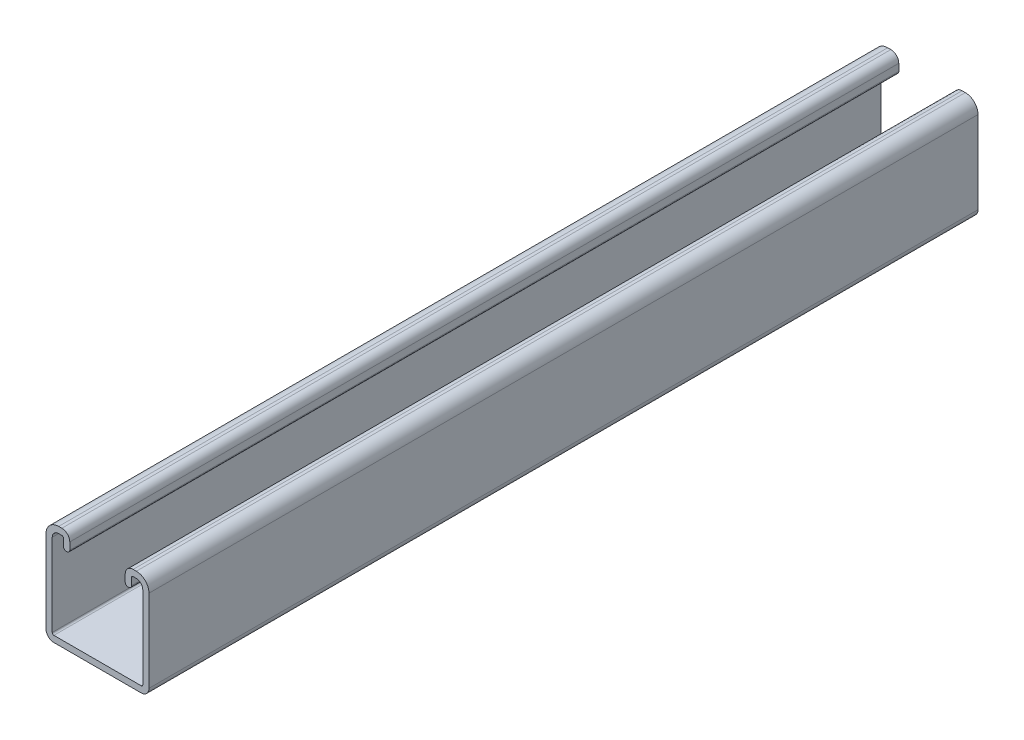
SolidWorks part; units mm, degrees
ref_plane "Front Plane" through (0, 0, 0) normal (0, 0, 1) x (1, 0, 0)
ref_plane "Top Plane" through (0, 0, 0) normal (0, 1, 0) x (1, 0, 0)
ref_plane "Right Plane" through (0, 0, 0) normal (1, 0, 0) x (0, 0, -1)
sketch "Sketch1" plane through (0, 0, 0) normal (0, 0, 1) x (1, 0, 0)
  line L1 (5.08, 41.275) -> (6.35, 41.275)
  line L2 (0, 36.195) -> (0, 3.175)
  line L3 (3.175, 0) -> (38.1, 0)
  line L4 (41.275, 36.195) -> (41.275, 3.175)
  line L8 (20.6375, 0) -> (20.6375, 51.8756) construction
  line L9 (9.525, 38.1) -> (9.525, 35.2743)
  line L10 (31.75, 38.1) -> (31.75, 35.2743)
  line L11 (34.925, 41.275) -> (36.195, 41.275)
  line L12 (7.025, 38.1) -> (7.025, 35.2743)
  line L13 (5.08, 38.775) -> (6.35, 38.775)
  line L14 (2.5, 36.195) -> (2.5, 3.175)
  line L15 (3.175, 2.5) -> (38.1, 2.5)
  line L16 (38.775, 36.195) -> (38.775, 3.175)
  line L17 (34.925, 38.775) -> (36.195, 38.775)
  line L18 (34.25, 38.1) -> (34.25, 35.2743)
  line L19 (8.168, 34.1313) -> (8.382, 34.1313)
  line L20 (32.893, 34.1313) -> (33.107, 34.1313)
  line L21 (31.75, 38.1) -> (31.75, 34.1313) construction
  line L22 (34.25, 38.1) -> (34.25, 34.1313) construction
  line L23 (7.025, 38.1) -> (7.025, 34.1313) construction
  line L24 (9.525, 38.1) -> (9.525, 34.1313) construction
  arc A0 (41.275, 3.175) -> (38.1, 0) centre (38.1, 3.175) cw
  arc A1 (0, 3.175) -> (3.175, 0) centre (3.175, 3.175) ccw
  arc A2 (41.275, 36.195) -> (36.195, 41.275) centre (36.195, 36.195) ccw
  arc A3 (0, 36.195) -> (5.08, 41.275) centre (5.08, 36.195) cw
  arc A4 (31.75, 38.1) -> (34.925, 41.275) centre (34.925, 38.1) cw
  arc A5 (9.525, 38.1) -> (6.35, 41.275) centre (6.35, 38.1) ccw
  arc A6 (7.025, 38.1) -> (6.35, 38.775) centre (6.35, 38.1) ccw
  arc A7 (2.5, 36.195) -> (5.08, 38.775) centre (5.08, 36.195) cw
  arc A8 (2.5, 3.175) -> (3.175, 2.5) centre (3.175, 3.175) ccw
  arc A9 (38.775, 3.175) -> (38.1, 2.5) centre (38.1, 3.175) cw
  arc A10 (38.775, 36.195) -> (36.195, 38.775) centre (36.195, 36.195) ccw
  arc A11 (34.25, 38.1) -> (34.925, 38.775) centre (34.925, 38.1) cw
  arc A12 (31.75, 35.2743) -> (32.893, 34.1313) centre (32.893, 35.2743) ccw
  arc A13 (33.107, 34.1313) -> (34.25, 35.2743) centre (33.107, 35.2743) ccw
  arc A14 (7.025, 35.2743) -> (8.168, 34.1313) centre (8.168, 35.2743) ccw
  arc A15 (8.382, 34.1313) -> (9.525, 35.2743) centre (8.382, 35.2743) ccw
  point P8 (0, 0)
  point P21 (31.75, 41.275)
  point P47 (31.75, 34.1313)
  point P58 (9.525, 34.1313)
  dimension "D3" = 3.175
  dimension "D6" = 5.08
  dimension "D7" = 3.175
  dimension "D9" = 1.143
  dimension "D1" = 41.275
  dimension "D2" = 41.275
  dimension "D4" = 22.225
  dimension "D5" = 7.1437
  dimension "D8" = 2.5
extrude "Boss-Extrude1" add sketch "Sketch1" along normal blind 332.232 contours A3 L1 A5 L9 A15 L19 A14 L12 A6 L13 A7 L14 A8 L15 A9 L16 A10 L17 A11 L18 A13 L20 A12 L10 A4 L11 A2 L4 A0 L3 A1 L2
sketch "Sketch3" plane through (0, 2.5, 0) normal (0, 1, 0) x (1, 0, 0)
  line L2 (3.175, 0) -> (38.1, 0) construction
  line L3 (34.925, -332.232) -> (34.925, 0) construction
  line L4 (36.195, -332.232) -> (36.195, 0) construction
  line L5 (5.08, -332.232) -> (5.08, 0) construction
  line L6 (6.35, -332.232) -> (6.35, 0) construction
  circle A0 centre (20.6375, -50.8) radius 2.54
  circle A1 centre (20.6375, -127) radius 2.54
  circle A2 centre (20.6375, -203.2) radius 2.54
  circle A3 centre (20.6375, -381) radius 2.54
  circle A4 centre (20.6375, -482.6) radius 2.54
  dimension "D1" = 5.08
  dimension "D2" = 5.08
  dimension "D3" = 5.08
  dimension "D4" = 5.08
  dimension "D5" = 5.08
  dimension "D11" = 15.5575
  dimension "D12" = 381
  dimension "D14" = 482.6
  dimension "D15" = 15.5575
  dimension "D6" = 50.8
  dimension "D7" = 14.2875
  dimension "D8" = 127
  dimension "D9" = 15.5575
  dimension "D10" = 203.2
  dimension "D13" = 14.2875
extrude "Cut-Extrude1" cut sketch "Sketch3" against normal through all
sketch "Sketch4" plane through (0, 2.5, 0) normal (0, 1, 0) x (1, 0, 0)
  circle A0 centre (20.6375, -272.6933) radius 2.54
  dimension "D1" = 5.08
extrude "Cut-Extrude2" cut sketch "Sketch4" against normal through all
